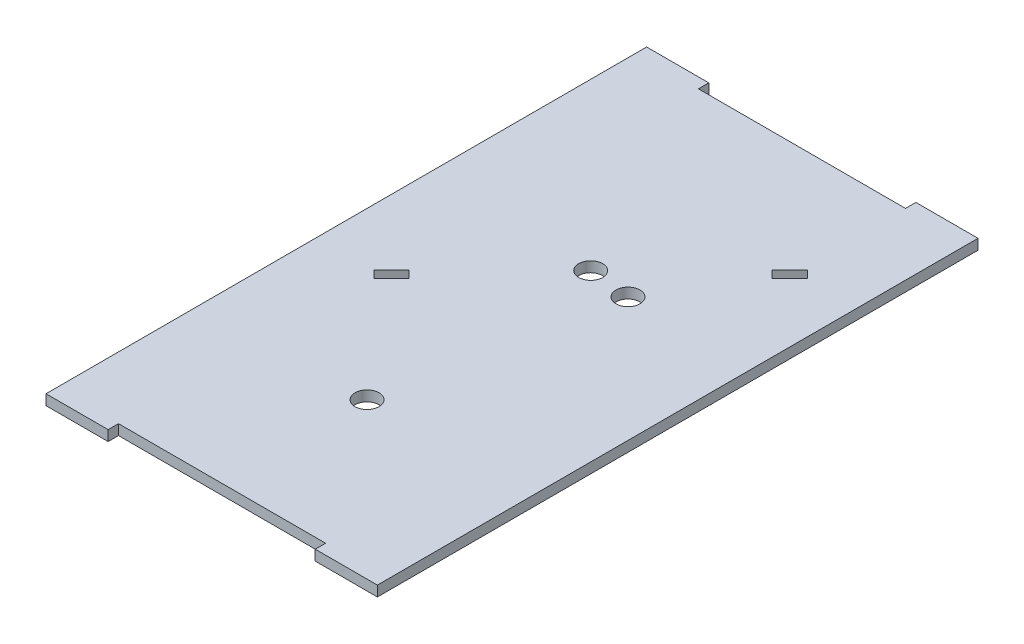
SolidWorks part; units mm, degrees
ref_plane "Front Plane" through (0, 0, 0) normal (0, 0, 1) x (1, 0, 0)
ref_plane "Top Plane" through (0, 0, 0) normal (0, 1, 0) x (1, 0, 0)
ref_plane "Right Plane" through (0, 0, 0) normal (1, 0, 0) x (0, 0, -1)
sketch "Sketch1" plane through (0, 0, 0) normal (0, 1, 0) x (1, 0, 0)
  line L0 (101.6, 0) -> (101.6, 177.8)
  line L1 (0, 0) -> (101.6, 0)
  line L2 (0, 0) -> (0, 177.8)
  line L3 (101.6, 177.8) -> (0, 177.8)
  dimension "D1" = 101.6
  dimension "D2" = 177.8
extrude "Boss-Extrude1" add sketch "Sketch1" along normal blind 3.175
sketch "Sketch2" plane through (0, 0, 0) normal (0, 1, 0) x (1, 0, 0)
  line L0 (101.6, 177.8) -> (0, 177.8) construction
  line L1 (0, 177.8) -> (19.05, 177.8)
  line L2 (0, 177.8) -> (0, 180.975)
  line L3 (0, 180.975) -> (19.05, 180.975)
  line L4 (19.05, 177.8) -> (19.05, 180.975)
  line L5 (50.8, 0) -> (50.8, 177.8) construction
  line L6 (0, 0) -> (101.6, 0) construction
  line L7 (101.6, 177.8) -> (101.6, 180.975)
  line L8 (101.6, 180.975) -> (82.55, 180.975)
  line L9 (82.55, 177.8) -> (82.55, 180.975)
  line L10 (0, 88.9) -> (101.6, 88.9) construction
  line L11 (0, 177.8) -> (0, 0) construction
  line L12 (101.6, 0) -> (101.6, 177.8) construction
  line L13 (101.6, 0) -> (101.6, -3.175)
  line L14 (101.6, -3.175) -> (82.55, -3.175)
  line L15 (82.55, 0) -> (82.55, -3.175)
  line L16 (0, 0) -> (0, -3.175)
  line L17 (0, -3.175) -> (19.05, -3.175)
  line L18 (19.05, 0) -> (19.05, -3.175)
  line L19 (101.6, 177.8) -> (82.55, 177.8)
  line L20 (101.6, 0) -> (82.55, 0)
  line L21 (0, 0) -> (19.05, 0)
  dimension "D1" = 19.05
  dimension "D2" = 0
  dimension "D3" = 3.175
extrude "Boss-Extrude2" add sketch "Sketch2" along normal blind 3.175
sketch "Sketch4" plane through (0, 3.175, 0) normal (0, 1, 0) x (1, 0, 0)
  line L0 (63.5, 177.8) -> (63.5, 111.76) construction
  line L2 (19.05, 0) -> (82.55, 0) construction
  line L3 (0, 180.975) -> (0, -3.175) construction
  line L4 (82.55, 177.8) -> (19.05, 177.8) construction
  circle A0 centre (63.5, 111.76) radius 3.683
  circle A1 centre (50.8, 44.45) radius 3.683
  circle A2 centre (50.8, 113.03) radius 3.683
  point P7 (50.8, 0)
  point P12 (50.8, 177.8)
  dimension "D2" = 7.366
  dimension "D4" = 7.366
  dimension "D6" = 7.366
  dimension "D1" = 66.04
  dimension "D3" = 44.45
  dimension "D5" = 63.5
  dimension "D7" = 64.77
extrude "Cut-Extrude2" cut sketch "Sketch4" against normal through all
sketch "Sketch5" plane through (0, 3.175, 0) normal (0, 1, 0) x (1, 0, 0)
  line L0 (50.8, 177.8) -> (50.8, 0) construction
  line L1 (0, 180.975) -> (0, -3.175) construction
  line L2 (17.4257, 79.9834) -> (22.8139, 85.3716)
  line L3 (17.4257, 79.9834) -> (19.6708, 77.7383)
  line L4 (19.6708, 77.7383) -> (25.0589, 83.1265)
  line L5 (82.55, 177.8) -> (19.05, 177.8) construction
  line L6 (19.05, 0) -> (82.55, 0) construction
  line L7 (22.8139, 85.3716) -> (25.0589, 83.1265)
  line L8 (50.8, 113.03) -> (23.9364, 84.249) construction
  line L9 (50.8, 113.03) -> (78.6388, 85.1912) construction
  line L10 (78.4584, 141.0161) -> (80.7035, 138.7711)
  line L11 (86.0917, 144.1592) -> (80.7035, 138.7711)
  line L12 (83.8466, 146.4043) -> (86.0917, 144.1592)
  line L13 (83.8466, 146.4043) -> (78.4584, 141.0161)
  circle A0 centre (50.8, 113.03) radius 33.02 construction
  circle A1 centre (50.8, 113.03) radius 39.37 construction
  point P15 (23.9364, 84.249)
  dimension "D4" = 66.04
  dimension "D5" = 7.62
  dimension "D1" = 78.74
  dimension "D2" = 45
  dimension "D3" = 3.175
extrude "Cut-Extrude4" cut sketch "Sketch5" against normal through all
